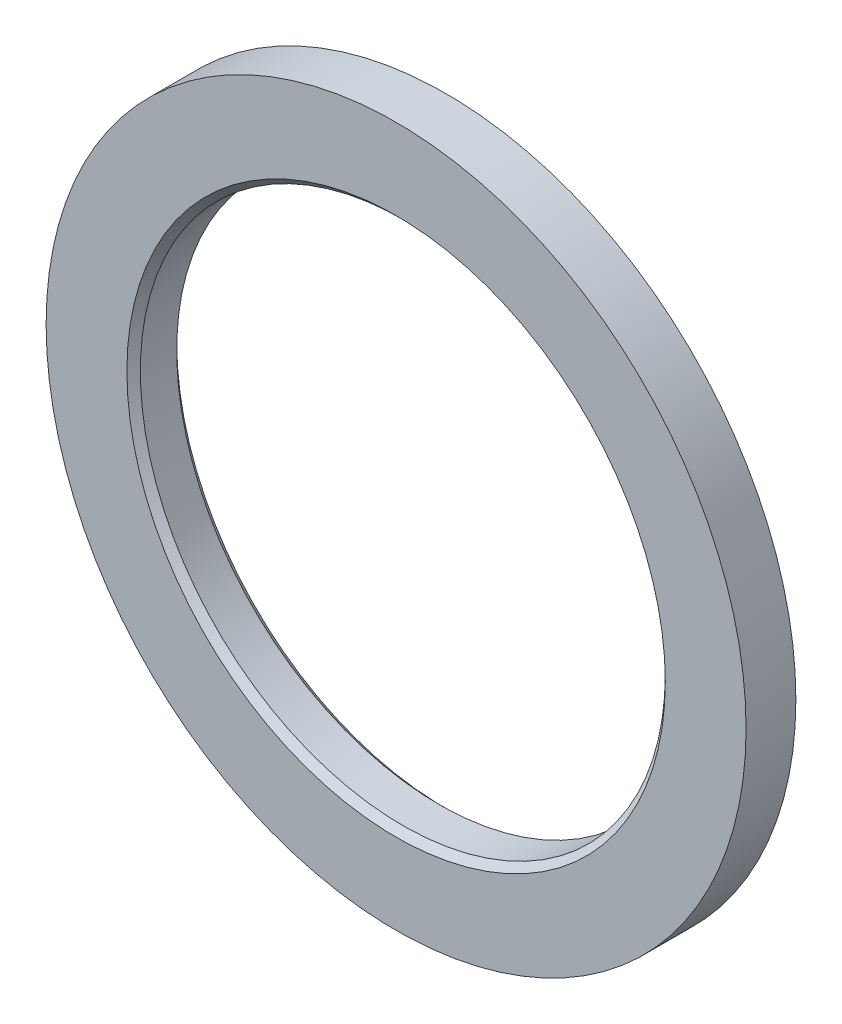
SolidWorks part; units mm, degrees
ref_plane "Plan1" through (0, 0, 0) normal (0, 0, 1) x (1, 0, 0)
ref_plane "Plan2" through (0, 0, 0) normal (0, 1, 0) x (1, 0, 0)
ref_plane "Plan3" through (0, 0, 0) normal (1, 0, 0) x (0, 0, -1)
sketch "Esquisse1" plane through (0, 0, 0) normal (0, 0, 1) x (1, 0, 0)
  line L0 (-50, 0) -> (60, 0) construction
  line L1 (0, 50) -> (0, -50) construction
  circle A0 centre (0, 0) radius 26
  circle A1 centre (0, 0) radius 19.5
  dimension "D1" = 52
  dimension "D2" = 39
extrude "Base-Extrusion" add sketch "Esquisse1" along normal blind 3.7
chamfer "Chanfrein1" distance 0.5 angle 45 2 edges at (19.5, 0, 0) (19.5, 0, 3.7)
